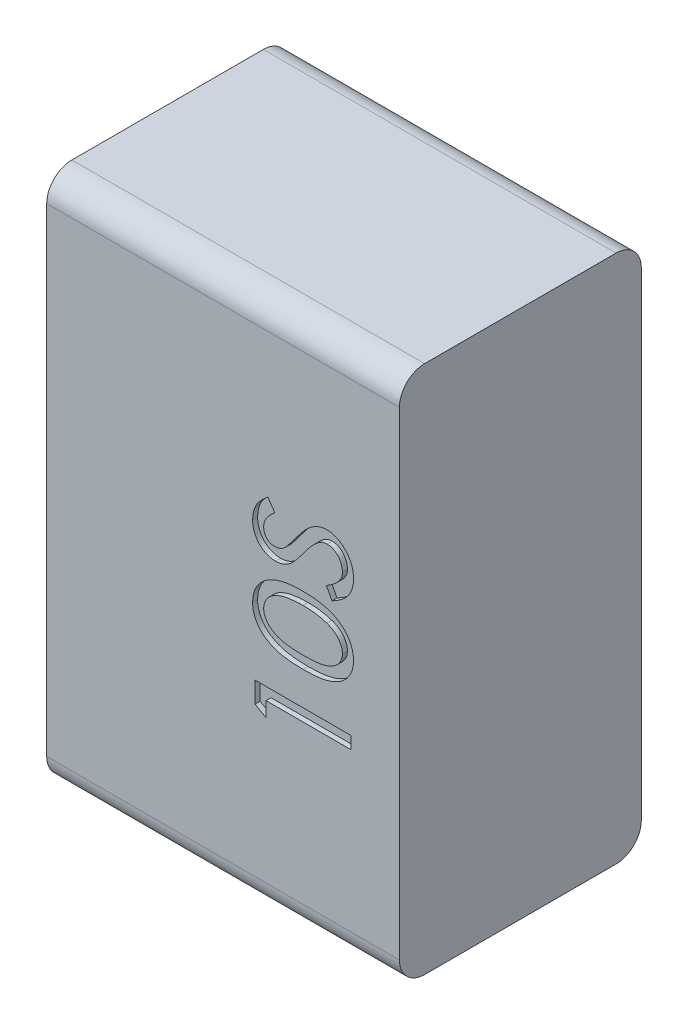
SolidWorks part; units mm, degrees
ref_plane "Plan de face" through (0, 0, 0) normal (0, 0, 1) x (1, 0, 0)
ref_plane "Plan de dessus" through (0, 0, 0) normal (0, 1, 0) x (1, 0, 0)
ref_plane "Plan de droite" through (0, 0, 0) normal (1, 0, 0) x (0, 0, -1)
sketch "Esquisse1" plane through (0, 0, 0) normal (0, 0, 1) x (1, 0, 0)
  line L0 (-35, 52.5) -> (-35, -52.5)
  line L1 (-35, 52.5) -> (35, 52.5)
  line L2 (-35, -52.5) -> (35, -52.5)
  line L3 (35, 52.5) -> (35, -52.5)
  line L4 (-35, 52.5) -> (35, -52.5) construction
  dimension "D1" = 70
  dimension "D2" = 105
extrude "Boss.-Extru.1" add sketch "Esquisse1" along normal mid plane 48
fillet "Congé1" radius 5 4 edges at (0, -52.5, -24) (0, -52.5, 24) (0, 52.5, -24) (0, 52.5, 24)
sketch "Esquisse2" plane through (0, 0, 24) normal (0, 0, 1) x (1, 0, 0)
  line L0 (25.3974, 39.7557) -> (25.3974, -41.7759) construction
  text T0 "<b>10S</b>" font "Century Gothic" height in points 72
extrude "Enlèv. mat.-Extru.1" cut sketch "Esquisse2" against normal blind 1
